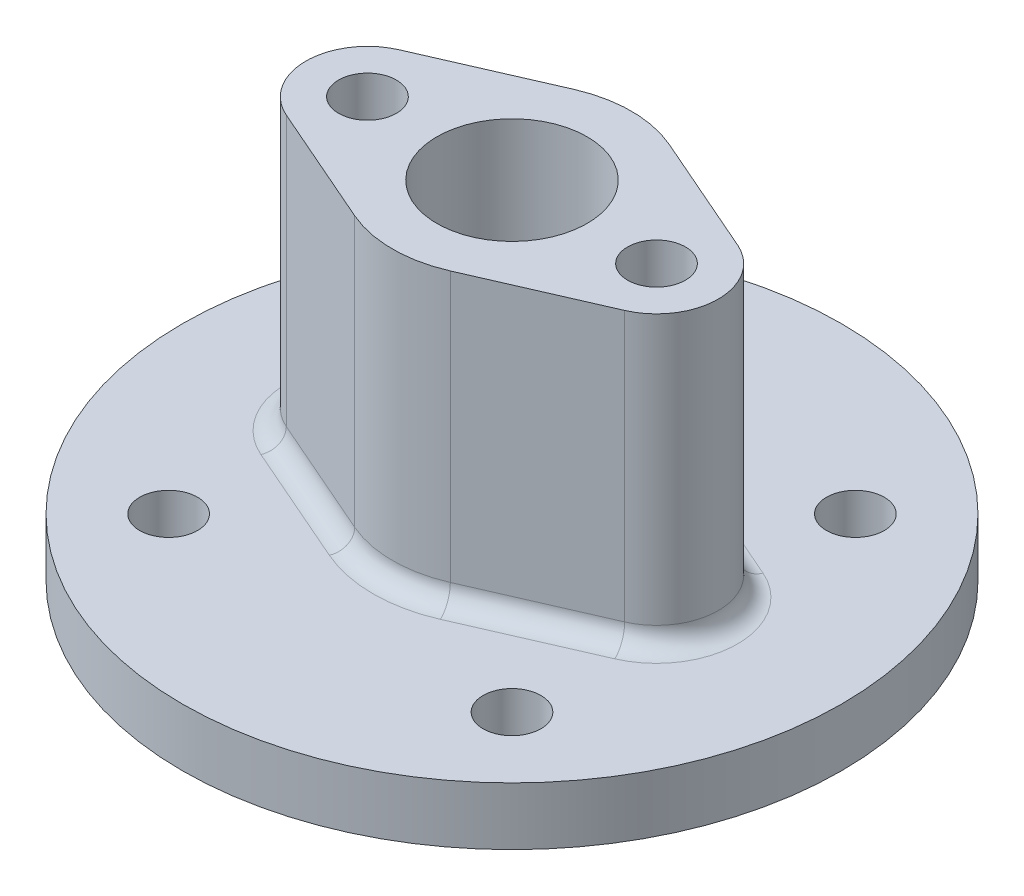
SolidWorks part; units mm, degrees
ref_plane "Front Plane" through (0, 0, 0) normal (0, 0, 1) x (1, 0, 0)
ref_plane "Top Plane" through (0, 0, 0) normal (0, 1, 0) x (1, 0, 0)
ref_plane "Right Plane" through (0, 0, 0) normal (1, 0, 0) x (0, 0, -1)
sketch "Sketch1" plane through (0, 0, 0) normal (0, 0, 1) x (1, 0, 0)
  line L0 (0, 0) -> (0, 79.1271) construction
  line L1 (0, 0) -> (0, 57)
  line L2 (0, 57) -> (85.5, 57)
  line L3 (85.5, 57) -> (85.5, 42)
  line L5 (0, 0) -> (24, 0)
  line L6 (24, 0) -> (42, 42)
  line L7 (42, 42) -> (85.5, 42)
  point P3 (0, 79.1271)
  dimension "D1" = 42
  dimension "D2" = 15
  dimension "D3" = 48
  dimension "D4" = 84
  dimension "D5" = 171
revolve "Revolve1" add sketch "Sketch1" angle 360 about L0
sketch "Sketch2" plane through (0, 57, 0) normal (0, 1, 0) x (1, 0, 0)
  line L0 (-43.9, 14.6642) -> (-12.4, 28.412)
  line L1 (-43.9, -14.6642) -> (-12.4, -28.412)
  line L2 (12.4, 28.412) -> (43.9, 14.6642)
  line L3 (12.4, -28.412) -> (43.9, -14.6642)
  line L4 (-37.5, 0) -> (37.5, 0) construction
  arc A0 (-12.4, -28.412) -> (12.4, -28.412) centre (0, 0) ccw
  arc A1 (43.9, -14.6642) -> (43.9, 14.6642) centre (37.5, 0) ccw
  arc A2 (-43.9, 14.6642) -> (-43.9, -14.6642) centre (-37.5, 0) ccw
  arc A3 (12.4, 28.412) -> (-12.4, 28.412) centre (0, 0) ccw
  point P1 (22.4404, 0)
  point P4 (0, 0)
  dimension "D1" = 31
  dimension "D2" = 16
  dimension "D3" = 75
extrude "Boss-Extrude1" add sketch "Sketch2" along normal blind 75
sketch "Sketch3" plane through (0, 0, 0) normal (0, 0, 1) x (1, 0, 0)
  line L0 (0, 0) -> (0, 141.1247) construction
  line L1 (0, 132) -> (19.5, 132)
  line L2 (12.4, 132) -> (43.9, 132) construction
  line L3 (19.5, 132) -> (19.5, 102)
  line L4 (19.5, 102) -> (10.5, 102)
  line L5 (10.5, 102) -> (10.5, 90)
  line L6 (10.5, 90) -> (19.5, 90)
  line L7 (19.5, 90) -> (19.5, 66)
  line L8 (19.5, 66) -> (13.5, 66)
  line L9 (13.5, 66) -> (13.5, 0)
  line L10 (-24, 0) -> (24, 0) construction
  line L11 (13.5, 0) -> (0, 0)
  line L12 (0, 0) -> (0, 132)
  line L13 (12.4, 132) -> (-12.4, 132) construction
  point P7 (0, 132)
  point P19 (0, 144.3252)
  point P20 (0, 139.2366)
  point P21 (0, 141.1247)
  dimension "D1" = 27
  dimension "D2" = 30
  dimension "D3" = 39
  dimension "D4" = 12
  dimension "D5" = 24
  dimension "D6" = 21
revolve "Cut-Revolve1" cut sketch "Sketch3" angle 360 about L0
hole_wizard "Ø15.0 (15) Diameter Hole1" positions "Sketch4" profile "Sketch5" hole size "Ø15.0" standard "ANSI Metric"
sketch "Sketch4" plane through (0, 132, 0) normal (0, 1, 0) x (1, 0, 0)
  point P0 (-37.5, 0)
  point P6 (0, 0)
sketch "Sketch5" plane through (-37.5, 132, 0) normal (1, 0, 0) x (0, 0, 1)
  line L0 (0, 0) -> (0, 29.5065)
  line L1 (0, 29.5065) -> (7.5, 25)
  line L2 (7.5, 25) -> (7.5, 0)
  line L5 (7.5, 0) -> (0, 0)
  line L10 (0, 29.5065) -> (-7.5, 25) construction
  line L11 (0, -6.35) -> (0, 107.95) construction
  dimension "Hole Dia." = 15
  dimension "Hole Depth" = 25
  dimension "Drill Angle" = 118
mirror "Mirror1" about plane through (0, 0, 0) normal (1, 0, 0) of "Ø15.0 (15) Diameter Hole1"
other "Hole1"
sketch "Sketch6" plane through (0, 57, 0) normal (0, 1, 0) x (1, 0, 0)
  line L1 (0, 0) -> (63, 0) construction
  circle A0 centre (44.5477, 44.5477) radius 7.5
  circle A1 centre (0, 0) radius 63 construction
  dimension "D1" = 15
  dimension "D2" = 126
  dimension "D3" = 45
pattern_circular "CirPattern1" count 4 over 360 about axis through (0, 0, 0) along (0, 1, 0) of "Hole1"
fillet "Fillet1" radius 5 8 edges at (-28.15, 57, 21.5381) (-53.5, 57, 0) (-28.15, 57, -21.5381) (0, 57, -31) (28.15, 57, -21.5381) (53.5, 57, 0) (28.15, 57, 21.5381) (0, 57, 31)
